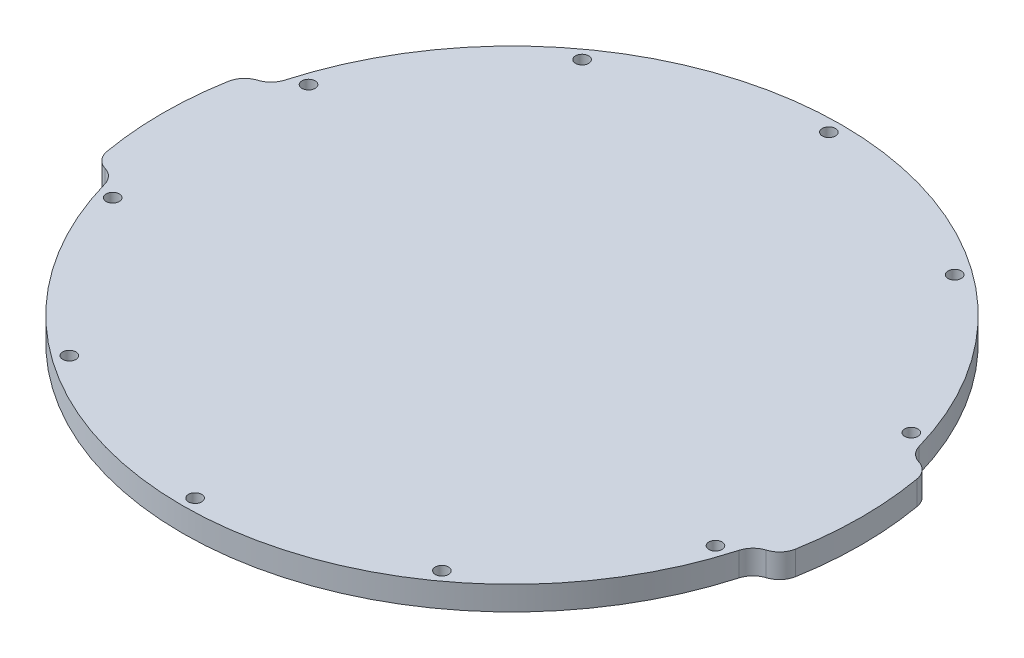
SolidWorks part; units mm, degrees
ref_plane "Front Plane" through (0, 0, 0) normal (0, 0, 1) x (1, 0, 0)
ref_plane "Top Plane" through (0, 0, 0) normal (0, 1, 0) x (1, 0, 0)
ref_plane "Right Plane" through (0, 0, 0) normal (1, 0, 0) x (0, 0, -1)
sketch "Sketch1" plane through (0, 0, 0) normal (0, 1, 0) x (1, 0, 0)
  line L0 (0, 0) -> (-86.2199, 15.2029) construction
  line L1 (0, 0) -> (-139.7786, 0) construction
  line L2 (0, 0) -> (-86.2199, -15.2029) construction
  line L3 (0, 0) -> (86.2199, 15.2029) construction
  line L4 (0, 0) -> (86.2199, -15.2029) construction
  circle A0 centre (0, 0) radius 79.35 construction
  circle A1 centre (0, 79.35) radius 1.65
  circle A2 centre (46.6408, 64.1955) radius 1.65
  circle A3 centre (75.4663, 24.5205) radius 1.65
  circle A4 centre (75.4663, -24.5205) radius 1.65
  circle A5 centre (46.6408, -64.1955) radius 1.65
  circle A6 centre (0, -79.35) radius 1.65
  circle A7 centre (-46.6408, -64.1955) radius 1.65
  circle A8 centre (-75.4663, -24.5205) radius 1.65
  circle A9 centre (-75.4663, 24.5205) radius 1.65
  circle A10 centre (-46.6408, 64.1955) radius 1.65
  circle A13 centre (0, 0) radius 82.55 construction
  circle A14 centre (0, 0) radius 87.55 construction
  arc A15 (-86.2199, -15.2029) -> (-86.2199, 15.2029) centre (0, 0) cw
  arc A16 (86.2199, -15.2029) -> (86.2199, 15.2029) centre (0, 0) ccw
  arc A17 (-86.2199, -15.2029) -> (-80.2789, -19.2301) centre (-81.2959, -14.3347) ccw
  arc A18 (-86.2199, 15.2029) -> (-80.2789, 19.2301) centre (-81.2959, 14.3347) cw
  arc A19 (86.2199, -15.2029) -> (80.2789, -19.2301) centre (81.2959, -14.3347) cw
  arc A20 (86.2199, 15.2029) -> (80.2789, 19.2301) centre (81.2959, 14.3347) ccw
  arc A21 (-80.2789, 19.2301) -> (80.2789, 19.2301) centre (0, 0) cw
  arc A22 (80.2789, -19.2301) -> (-80.2789, -19.2301) centre (0, 0) cw
  point P28 (0, 0)
  point P30 (0, 0)
  dimension "D1" = 3.3
  dimension "D2" = 158.7
  dimension "D4" = 165.1
  dimension "D5" = 5
  dimension "D6" = 10
extrude "Boss-Extrude1" add sketch "Sketch1" along normal blind 6
fillet "Fillet1" radius 5 4 edges at (80.2789, 3, 19.2301) (80.2789, 3, -19.2301) (-80.2789, 3, -19.2301) (-80.2789, 3, 19.2301)
